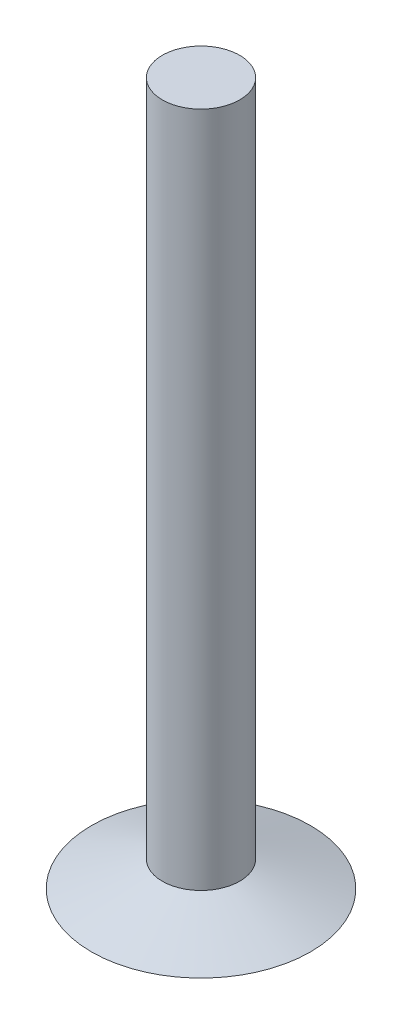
SolidWorks part; units mm, degrees
ref_plane "Front Plane" through (0, 0, 0) normal (0, 0, 1) x (1, 0, 0)
ref_plane "Top Plane" through (0, 0, 0) normal (0, 1, 0) x (1, 0, 0)
ref_plane "Right Plane" through (0, 0, 0) normal (1, 0, 0) x (0, 0, -1)
sketch "Sketch1" plane through (0, 0, 0) normal (0, 1, 0) x (1, 0, 0)
  circle A0 centre (0, 0) radius 60
  dimension "D1" = 120
extrude "Boss-Extrude1" add sketch "Sketch1" along normal blind 1050 and the other way blind 40 draft 70
